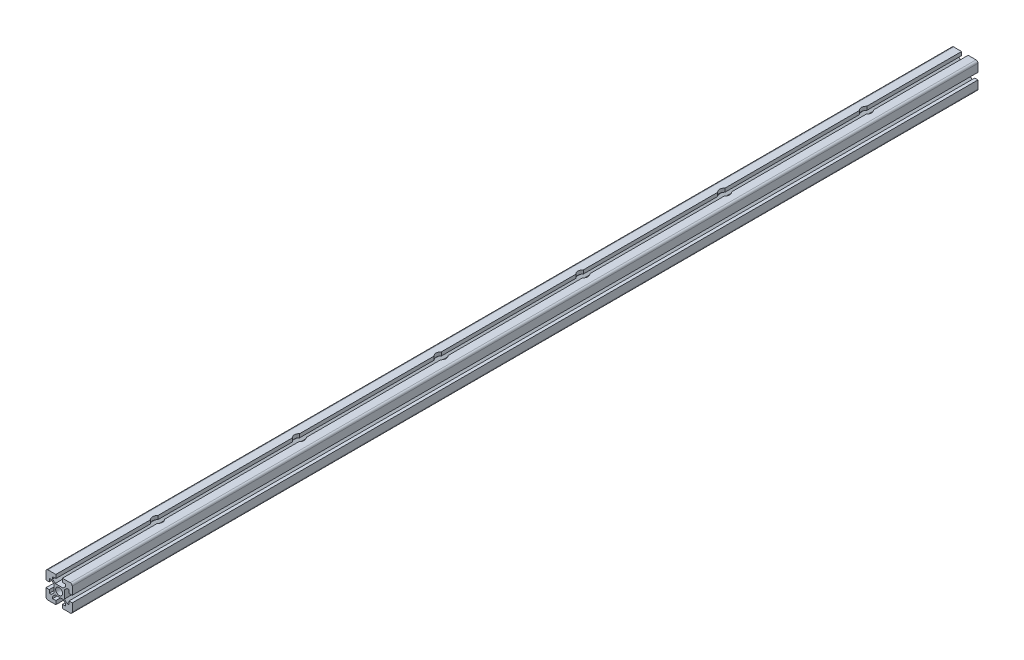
SolidWorks part; units mm, degrees
ref_plane "前基準面" through (0, 0, 0) normal (0, 0, 1) x (1, 0, 0)
ref_plane "上基準面" through (0, 0, 0) normal (0, 1, 0) x (1, 0, 0)
ref_plane "右基準面" through (0, 0, 0) normal (1, 0, 0) x (0, 0, -1)
sketch "草圖1" plane through (0, 0, 0) normal (0, 0, 1) x (1, 0, 0)
  line L0 (15, -5.5) -> (10, -5.5)
  line L1 (3, 0) -> (15, 0)
  line L2 (0, -3) -> (0, -15)
  line L3 (3, -40) -> (15, -40)
  line L4 (40, -3) -> (40, -15)
  line L5 (24.67, -40) -> (37, -40)
  line L6 (15, 0) -> (15, -5.5)
  line L7 (25, 0) -> (37, 0)
  line L8 (25, 0) -> (25, -5.5)
  line L9 (10, -5.5) -> (10, -8.5)
  line L10 (10, -8.5) -> (14, -12.5)
  line L11 (14, -12.5) -> (26, -12.5)
  line L12 (26, -12.5) -> (30, -8.5)
  line L13 (30, -8.5) -> (30, -5.5)
  line L14 (30, -5.5) -> (25, -5.5)
  line L17 (0, -25) -> (0, -37)
  line L18 (30, -34.5) -> (25, -34.5)
  line L19 (30, -31.5) -> (30, -34.5)
  line L20 (26, -27.5) -> (30, -31.5)
  line L21 (14, -27.5) -> (26, -27.5)
  line L22 (10, -31.5) -> (14, -27.5)
  line L23 (10, -34.5) -> (10, -31.5)
  line L24 (25, -40) -> (25, -34.5)
  line L25 (5, -15) -> (5, -10)
  line L26 (0, -15) -> (5, -15)
  line L27 (15, -40) -> (15, -34.5)
  line L28 (0, -25) -> (5, -25)
  line L29 (15, -34.5) -> (10, -34.5)
  line L30 (5, -10) -> (8, -10)
  line L31 (8, -10) -> (12, -14)
  line L32 (12, -14) -> (12, -26)
  line L33 (12, -26) -> (8, -30)
  line L34 (8, -30) -> (5, -30)
  line L35 (5, -30) -> (5, -25)
  line L36 (35, -30) -> (35, -25)
  line L37 (32, -30) -> (35, -30)
  line L38 (28, -26) -> (32, -30)
  line L39 (28, -14) -> (28, -26)
  line L40 (32, -10) -> (28, -14)
  line L41 (35, -10) -> (32, -10)
  line L42 (40, -25) -> (35, -25)
  line L43 (40, -15) -> (35, -15)
  line L44 (35, -15) -> (35, -10)
  line L45 (40, -25) -> (40, -37)
  circle A0 centre (20, -20) radius 5.25
  arc A1 (37, -40) -> (40, -37) centre (37, -37) ccw
  arc A2 (0, -37) -> (3, -40) centre (3, -37) ccw
  arc A3 (37, 0) -> (40, -3) centre (37, -3) cw
  arc A4 (3, 0) -> (0, -3) centre (3, -3) ccw
  point P52 (0, -40)
  point P55 (40, 0)
  point P58 (0, 0)
  dimension "D23" = 10.5
  dimension "D26" = 3
  dimension "D1" = 40
  dimension "D2" = 40
  dimension "D3" = 10
  dimension "D4" = 20
  dimension "D5" = 5
  dimension "D6" = 7
  dimension "D7" = 7
  dimension "D8" = 5.5
  dimension "D9" = 12
  dimension "D10" = 4
  dimension "D11" = 4
  dimension "D12" = 20
  dimension "D13" = 10
  dimension "D14" = 5
  dimension "D15" = 5
  dimension "D16" = 7
  dimension "D17" = 12
  dimension "D18" = 4
  dimension "D19" = 3
  dimension "D20" = 3
  dimension "D21" = 15
  dimension "D22" = 15
  dimension "D24" = 20
  dimension "D25" = 20
extrude "填料-伸長1" add sketch "草圖1" along normal blind 1380 contours L1 A4 L2 L26 L25 L30 L31 L32 L33 L34 L35 L28 L17 A2 L3 L27 L29 L23 L22 L21 L20 L19 L18 L24 L5 A1 L45 L42 L36 L37 L38 L39 L40 L41 L44 L43 L4 A3 L7 L8 L14 L13 L12 L11 L10 L9 L0 L6 A0
hole_wizard "M8 六角承窩頭蓋螺釘的柱孔1" positions "草圖5" profile "草圖4" counterbore size "M8" standard "ISO"
sketch "草圖5" plane through (0, 0, 0) normal (0, 1, 0) x (-1, 0, 0)
  line L0 (0, 1380) -> (0, 0) construction
  line L1 (-3, 0) -> (-15, 0) construction
  point P0 (-20, 150)
  dimension "D1" = 20
  dimension "D2" = 150
sketch "草圖4" plane through (20, 0, 150) normal (1, 0, 0) x (0, 0, 1)
  line L0 (0, 0) -> (0, 40)
  line L1 (0, 40) -> (4.5, 40)
  line L3 (4.5, 40) -> (4.5, 8)
  line L4 (4.5, 8) -> (7.5, 8)
  line L5 (7.5, 8) -> (7.5, 0)
  line L7 (7.5, 0) -> (0, 0)
  line L11 (0, -6.35) -> (0, 107.95) construction
  dimension "貫穿孔直徑" = 9
  dimension "貫穿孔深度" = 40
  dimension "柱孔直徑" = 15
  dimension "柱孔深度" = 8
pattern_linear "直線複製排列1" count 6 spacing 216 along (0, 0, 1) of "M8 六角承窩頭蓋螺釘的柱孔1"
